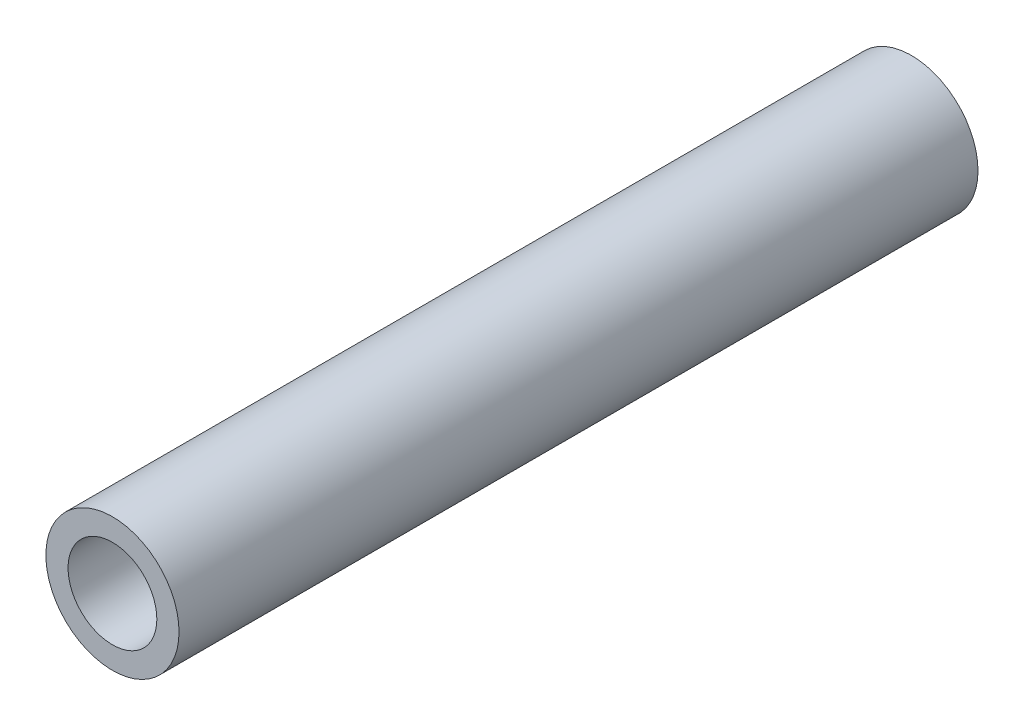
SolidWorks part; units mm, degrees
ref_plane "Front Plane" through (0, 0, 0) normal (0, 0, 1) x (1, 0, 0)
ref_plane "Top Plane" through (0, 0, 0) normal (0, 1, 0) x (1, 0, 0)
ref_plane "Right Plane" through (0, 0, 0) normal (1, 0, 0) x (0, 0, -1)
sketch "Sketch1" plane through (0, 0, 0) normal (0, 0, 1) x (1, 0, 0)
  circle A0 centre (0, 0) radius 2
  circle A1 centre (0, 0) radius 3
  dimension "D1" = 4
  dimension "D2" = 6
extrude "Boss-Extrude1" add sketch "Sketch1" along normal blind 36
